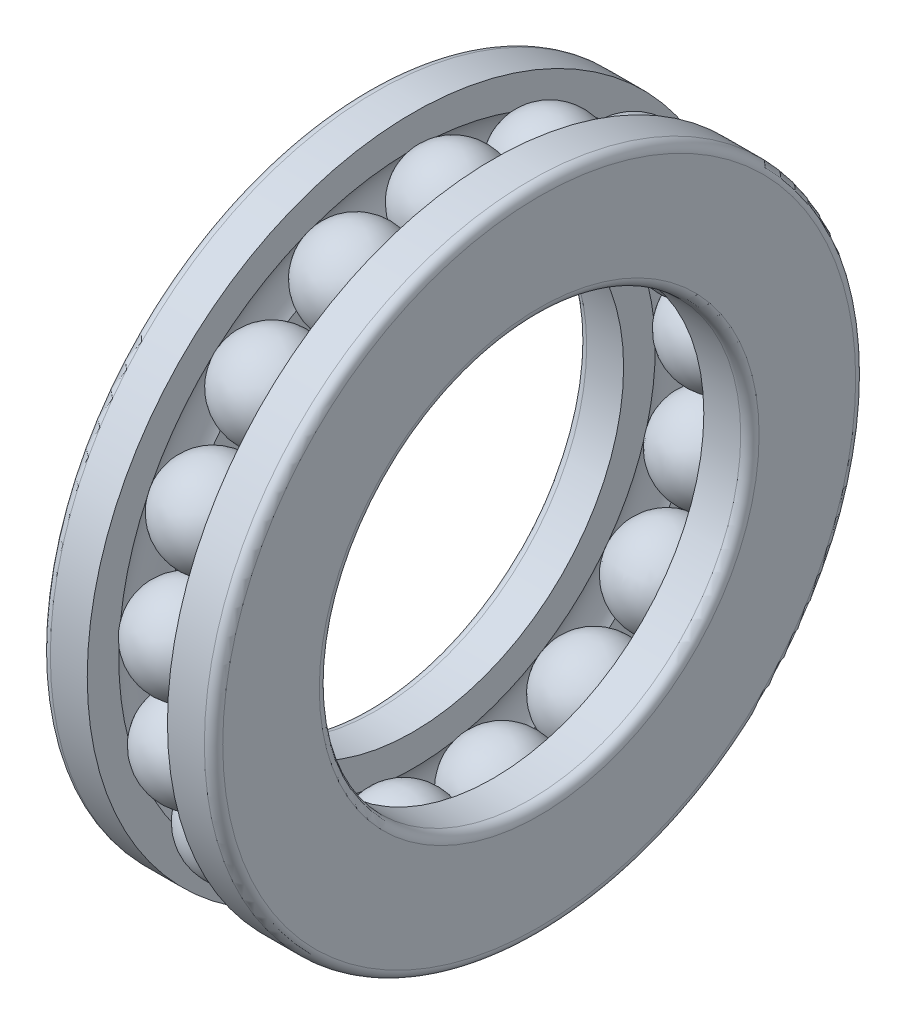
SolidWorks part; units mm, degrees
ref_plane "Plane1" through (0, 0, 0) normal (0, 0, 1) x (1, 0, 0)
ref_plane "Plane2" through (0, 0, 0) normal (0, 1, 0) x (1, 0, 0)
ref_plane "Plane3" through (0, 0, 0) normal (1, 0, 0) x (0, 0, -1)
sketch "Clipboard" plane through (0, 0, 0) normal (0, 0, 1) x (1, 0, 0)
  line L0 (-10, 0) -> (10, 0) construction
  line L1 (0, 0) -> (21.3836, -6.5376)
  line L2 (0, 0) -> (27.3662, 35.0271)
  line L3 (0, 0) -> (13.7666, -17.6205)
  line L4 (0, 0) -> (-22.3471, -0.7804)
  dimension "BallCLRad" = 44.45
  dimension "Count" = 52
  dimension "Show_count" = 52
  dimension "Max_count" = 17
  dimension "Min_count" = 2
sketch "InnRacSke" plane through (0, 0, 0) normal (0, 0, 1) x (1, 0, 0)
  line L0 (-6.6469, 40.1581) -> (-6.6469, 34.925)
  line L1 (-6.6469, 34.925) -> (-12.7635, 34.925)
  line L2 (-14.2875, 36.449) -> (-14.2875, 52.451)
  line L3 (-12.7635, 53.975) -> (-6.6469, 53.975)
  line L4 (-6.6469, 53.975) -> (-6.6469, 48.7419)
  line L5 (-34.925, 0) -> (34.925, 0) construction
  line L6 (0, 0) -> (0, 25.4) construction
  arc A0 (-12.7635, 34.925) -> (-14.2875, 36.449) centre (-12.7635, 36.449) cw
  arc A1 (-14.2875, 52.451) -> (-12.7635, 53.975) centre (-12.7635, 52.451) cw
  arc A2 (-6.6469, 48.7419) -> (-6.6469, 40.1581) centre (0, 44.45) ccw
  dimension "Ball_diameter" = 15.8242
  dimension "ID" = 69.85
  dimension "OD" = 107.95
  dimension "Width" = 28.575
  dimension "gap" = 13.2937
  dimension "BallCLRad" = 44.45
revolve "Race" add sketch "InnRacSke" angle 360 about L5
ref_axis "Axis1" through (-50, 0, 0) along (1, 0, 0)
sketch "BalDetSke" plane through (0, 0, 0) normal (0, 0, 1) x (1, 0, 0)
  line L0 (-7.9375, 44.45) -> (7.9375, 44.45)
  line L1 (-14.5732, 44.45) -> (14.5732, 44.45) construction
  arc A0 (7.9375, 44.45) -> (-7.9375, 44.45) centre (0, 44.45) cw
  dimension "Ball_diameter" = 15.875
  dimension "BallCLRad" = 44.45
revolve "BallDetailed" add sketch "BalDetSke" angle 360 about L1
sketch "BalSimSke" plane through (0, 0, 0) normal (0, 0, 1) x (1, 0, 0)
  line L0 (-25.4, 0) -> (25.4, 0) construction
  circle A0 centre (0, 44.45) radius 7.9375
  dimension "Ball_diameter" = 15.875
  dimension "BallCLRad" = 44.45
revolve "BallsSimplified" [suppressed] add sketch "BalSimSke" angle 360 about L0
mirror "Mirror1" about plane through (0, 0, 0) normal (1, 0, 0) of "Race"
pattern_circular "BallsDetailed" count 17 every 21.176 about axis through (-50, 0, 0) along (1, 0, 0) of "BallDetailed"
sketch "CagSpiSke" plane through (0, 0, 0) normal (0, 0, 1) x (1, 0, 0)
  line L0 (1.9844, 35.7188) -> (1.9844, 53.1812)
  line L1 (1.9844, 53.1812) -> (-1.9844, 53.1812)
  line L2 (-1.9844, 53.1812) -> (-1.9844, 35.7188)
  line L3 (-1.9844, 35.7188) -> (1.9844, 35.7188)
  line L4 (-34.925, 0) -> (34.925, 0) construction
  line L5 (0, 0) -> (0, 50.8) construction
  dimension "Thickness" = 3.9688
  dimension "ID" = 71.4375
  dimension "OD" = 106.3625
revolve "CageSpine" [suppressed] add sketch "CagSpiSke" angle 360 about L4
equation "\"BallCLRad@Clipboard\" =  ( \"OD@InnRacSke\" + \"ID@InnRacSke\" )  / 4"
equation "\"BallCLRad@BalSimSke\" = \"BallCLRad@Clipboard\""
equation "\"BallCLRad@BalDetSke\" = \"BallCLRad@Clipboard\""
equation "\"BallCLRad@InnRacSke\" = \"BallCLRad@Clipboard\""
equation "\"Ball_diameter@InnRacSke\" = \"Ball_diameter@BalDetSke\" - 0.002"
equation "\"Ball_diameter@BalSimSke\" = \"Ball_diameter@BalDetSke\""
equation "\"Max_count@Clipboard\" = int( 3.14159265 / atn(( \"Ball_diameter@BalDetSke\" / 2) / sqr( \"BallCLRad@Clipboard\"  *  \"BallCLRad@Clipboard\" - ( \"Ball_diameter@BalDetSke\" / 2) *  ( \"Ball_diameter@BalDetSke\" "
equation "\"Max_count@Clipboard\" = ((sgn( \"Max_count@Clipboard\" - \"Count@Clipboard\" )-1)*( \"Max_count@Clipboard\" - \"Count@Clipboard\" ))/-2+ \"Count@Clipboard\""
equation "\"Count@BallsDetailed\" = int( \"Show_count@Clipboard\" ) "
equation "\"Count@BallsDetailed\" = ((sgn( \"Count@BallsDetailed\" - \"Max_count@Clipboard\" )-1)*( \"Count@BallsDetailed\" - \"Max_count@Clipboard\" ))/-2+ \"Max_count@Clipboard\""
equation "\"Count@BallsDetailed\" = ((sgn( \"Count@BallsDetailed\" - \"Min_count@Clipboard\" )+1)*( \"Count@BallsDetailed\" - \"Min_count@Clipboard\"))/2 +\"Min_count@Clipboard\""
equation "\"Angle@BallsDetailed\" = 360.0 / \"Max_count@Clipboard\""
equation "\"Angle@CageSpine\" =  \"Angle@BallsDetailed\" * ( \"Count@BallsDetailed\" -1 + int( \"Count@BallsDetailed\" / \"Max_count@Clipboard\" ) )  + 0.001 -  int( \"Count@BallsDetailed\" / \"Max_count@Clipboard\" ) * 0.00"
equation "\"Angle@CageSpine\" =  \"Angle@CageSpine\" * int( \"Min_count@Clipboard\" / 2) + int(1 / \"Min_count@Clipboard\")  * 0.001"
equation "\"Thickness@CagSpiSke\" =  \"Ball_diameter@BalDetSke\" * 0.25"
equation "\"OD@CagSpiSke\" = ( \"OD@InnRacSke\" + ( \"BallCLRad@Clipboard\" * 2 + \"Ball_diameter@BalDetSke\" )) / 2"
equation "\"ID@CagSpiSke\" = ( \"ID@InnRacSke\" + ( \"BallCLRad@Clipboard\" * 2 - \"Ball_diameter@BalDetSke\" )) / 2"
